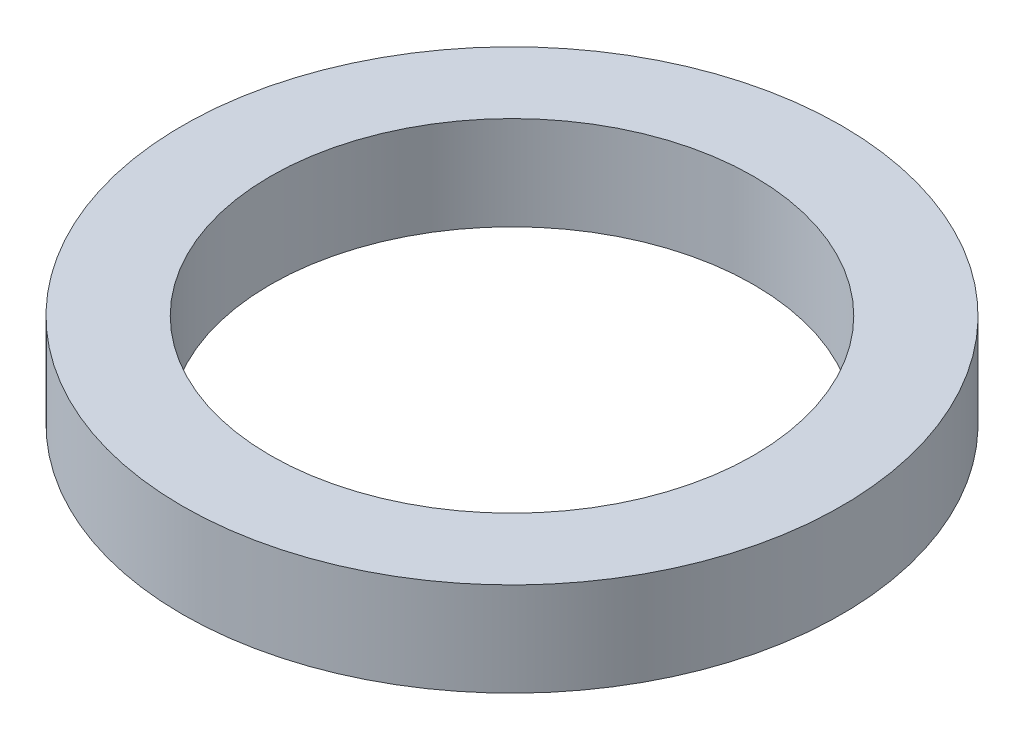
SolidWorks part; units mm, degrees
ref_plane "Front Plane" through (0, 0, 0) normal (0, 0, 1) x (1, 0, 0)
ref_plane "Top Plane" through (0, 0, 0) normal (0, 1, 0) x (1, 0, 0)
ref_plane "Right Plane" through (0, 0, 0) normal (1, 0, 0) x (0, 0, -1)
sketch "Sketch2" plane through (0, 0, 0) normal (0, 1, 0) x (1, 0, 0)
  circle A0 centre (0, 0) radius 20.955
  circle A1 centre (0, 0) radius 28.575
extrude "Boss-Extrude1" add sketch "Sketch2" along normal blind 8.128
